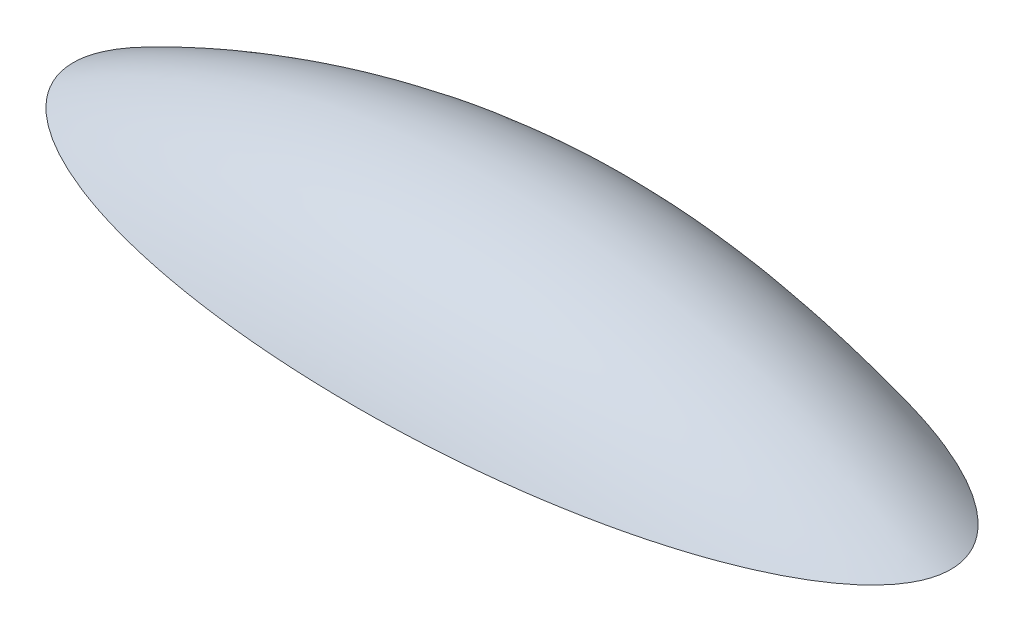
SolidWorks part; units mm, degrees
ref_plane "Front" through (0, 0, 0) normal (0, 0, 1) x (1, 0, 0)
ref_plane "Top" through (0, 0, 0) normal (0, 1, 0) x (1, 0, 0)
ref_plane "Right" through (0, 0, 0) normal (1, 0, 0) x (0, 0, -1)
sketch "Sketch1" plane through (0, 0, 0) normal (0, 1, 0) x (1, 0, 0)
  ellipse E0 centre (0, 0) end of major axis (-51.8031, 0) minor radius 18.5145
sketch "Sketch2" plane through (0, 0, 0) normal (0, 0, 1) x (1, 0, 0)
  arc A0 (-51.8031, 0) -> (51.8031, 0) centre (0, -93.8043) cw
sketch "Sketch3" plane through (0, 0, 0) normal (1, 0, 0) x (0, 0, -1)
  arc A0 (-18.5145, 0) -> (18.5145, 0) centre (0, -6.285) cw
surface "Surface-Fill2"
